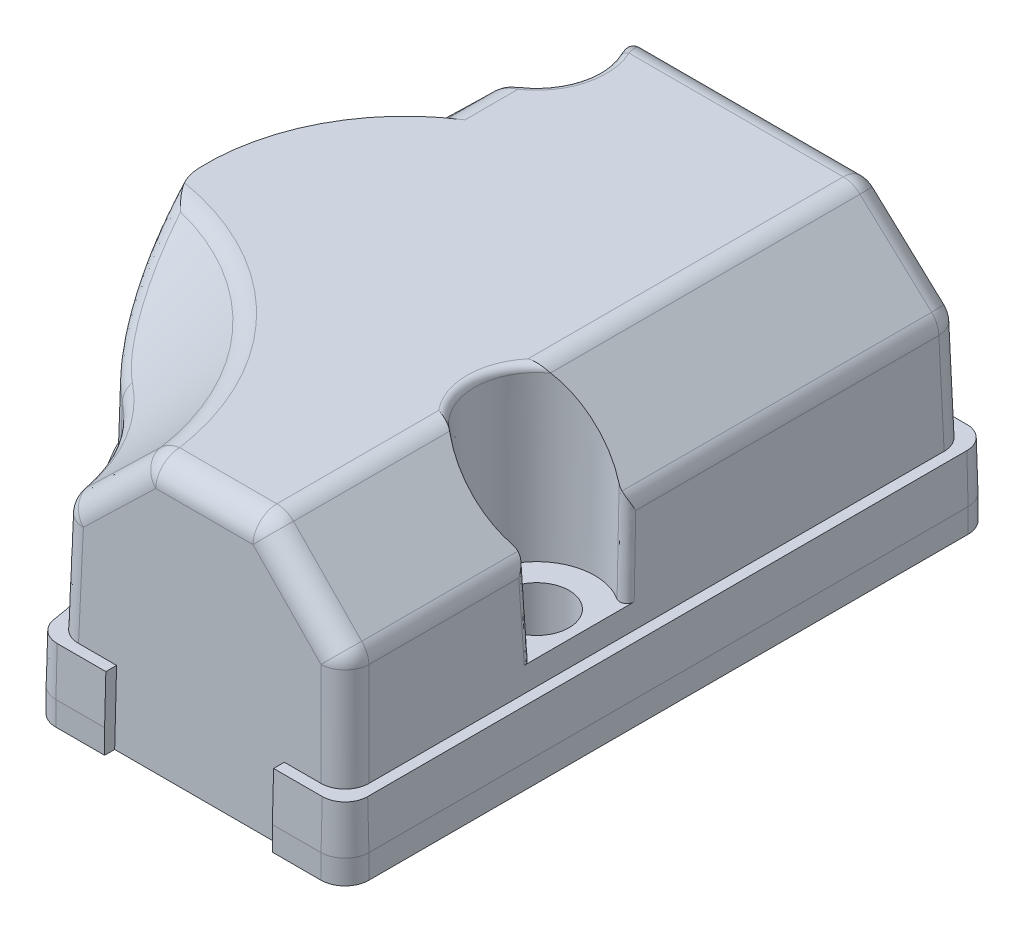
SolidWorks part; units mm, degrees
ref_plane "Front Plane" through (0, 0, 0) normal (0, 0, 1) x (1, 0, 0)
ref_plane "Top Plane" through (0, 0, 0) normal (0, 1, 0) x (1, 0, 0)
ref_plane "Right Plane" through (0, 0, 0) normal (1, 0, 0) x (0, 0, -1)
imported_body "Imported3"
ref_plane "Plane1" through (-0.5307, 0, 0) normal (-1, 0, 0) x (0, -1, 0)
sketch "Sketch1" plane through (-0.5307, 0, 0) normal (-1, 0, 0) x (0, -1, 0)
  line L0 (0, 12) -> (0, 12.5)
  line L1 (0, 12.5) -> (-2, 12.4476)
  line L2 (-2, 12.4476) -> (-2, 12)
  line L3 (-2, 12) -> (0, 12)
extrude "Cut-Extrude1" cut sketch "Sketch1" against normal blind 7
sketch "Sketch2" plane through (0, 0, 0) normal (0, -1, 0) x (1, 0, 0)
  line L0 (6.4693, 12) -> (6.4693, 12.5)
  line L1 (6.4693, 12.5) -> (9.5, 12.5)
  line L2 (9.5, 12.5) -> (9.5, -14.5)
  line L3 (9.5, -14.5) -> (-9.5, -14.5)
  line L4 (-9.5, -14.5) -> (-9.5, 0)
  line L5 (-3.5, 12.5) -> (-0.5307, 12.5)
  line L6 (-0.5307, 12.5) -> (-0.5307, 12)
  line L7 (-0.5307, 12) -> (6.4693, 12)
  arc A0 (-9.5, 0) -> (-6.125, 7.0256) centre (-0.5, 0) cw
  arc A1 (-6.125, 7.0256) -> (-3.5, 12.5) centre (-10.5, 12.49) ccw
extrude "Boss-Extrude1" add sketch "Sketch2" along normal blind 1
draft "Draft1" type of draft neutral plane draft angle 1.5 faces to draft 1 parameters "D1"=1.5
draft "Draft2" type of draft neutral plane draft angle 1.5 faces to draft 6 parameters "D1"=1.5
ref_plane "Plane2" through (0, 0, -11.6) normal (0, 0, 1) x (1, 0, 0)
sketch "Sketch3" plane through (0, 0, -11.6) normal (0, 0, 1) x (1, 0, 0)
  line L0 (-3.9905, 10) -> (-6.6, 10)
  line L1 (-6.6, 10) -> (-6.6, -1)
  line L2 (-6.6, -1) -> (-5.25, -1)
  line L3 (-5.25, -1) -> (-5.25, 3)
  line L4 (-5.25, 3) -> (-4.1738, 3)
  line L5 (-4.1738, 3) -> (-3.9905, 10)
  line L6 (-6.6, 10) -> (-6.6, -1) construction
revolve "Cut-Revolve1" cut sketch "Sketch3" angle 360 about L6
ref_plane "Plane3" through (0, 0, 2.2) normal (0, 0, 1) x (1, 0, 0)
sketch "Sketch4" plane through (0, 0, 2.2) normal (0, 0, 1) x (1, 0, 0)
  line L0 (9.8095, 10) -> (7.2, 10)
  line L1 (7.2, 10) -> (7.2, -1)
  line L2 (7.2, -1) -> (8.55, -1)
  line L3 (8.55, -1) -> (8.55, 3)
  line L4 (8.55, 3) -> (9.6262, 3)
  line L5 (9.6262, 3) -> (9.8095, 10)
  line L6 (7.2, 10) -> (7.2, -1) construction
revolve "Cut-Revolve2" cut sketch "Sketch4" angle 360 about L6
fillet "Fillet1" radius 1 19 edges at (-6.7548, 6.8399, 5.5668) (8.8798, 6.5916, -6.7793) (8.8798, 6.5916, 7.9793) (8.9399, 4.2958, 11.9399) (8.9399, 4.2958, -13.9399) (7.1288, 8.2973, -0.3639) (7.1304, 8.2958, -13.8351) (7.1288, 8.2973, 4.7639) (7.1304, 8.2958, 11.8351) (5.381, 10, -6.7307) (5.381, 10, 7.9307) (-8.8798, 6.5916, -5.2628) (-3.7576, 6.5916, 8.9207) (2.9971, 10, 11.7905) (-2.2311, 10, 5.0511) (-5.381, 10, -7.9971) (0.0995, 10, -13.7905)
fillet "Fillet2" radius 0.3 10 edges at (-5.7395, 4.9454, -13.9229) (-4.9035, 9.6563, -13.5709) (-8.8703, 6.3602, -10.5198) (-4.0461, 10, -11.0645) (-7.2725, 8.1574, -9.1286) (-5.4117, 9.8993, -9.2798) (4.5905, 10, 2.2)
fillet "VarFillet1" radius 1 2 edges at (9.4738, 1, -14.4738) (9.5, -0.5, -14.5)
fillet "VarFillet2" radius 1 2 edges at (-9.4738, 1, -14.4738) (-9.5, -0.5, -14.5)
fillet "VarFillet3" radius 1 2 edges at (-3.5, -0.5, 12.5)
fillet "VarFillet4" radius 1 2 edges at (9.4738, 1, 12.4738) (9.5, -0.5, 12.5)
